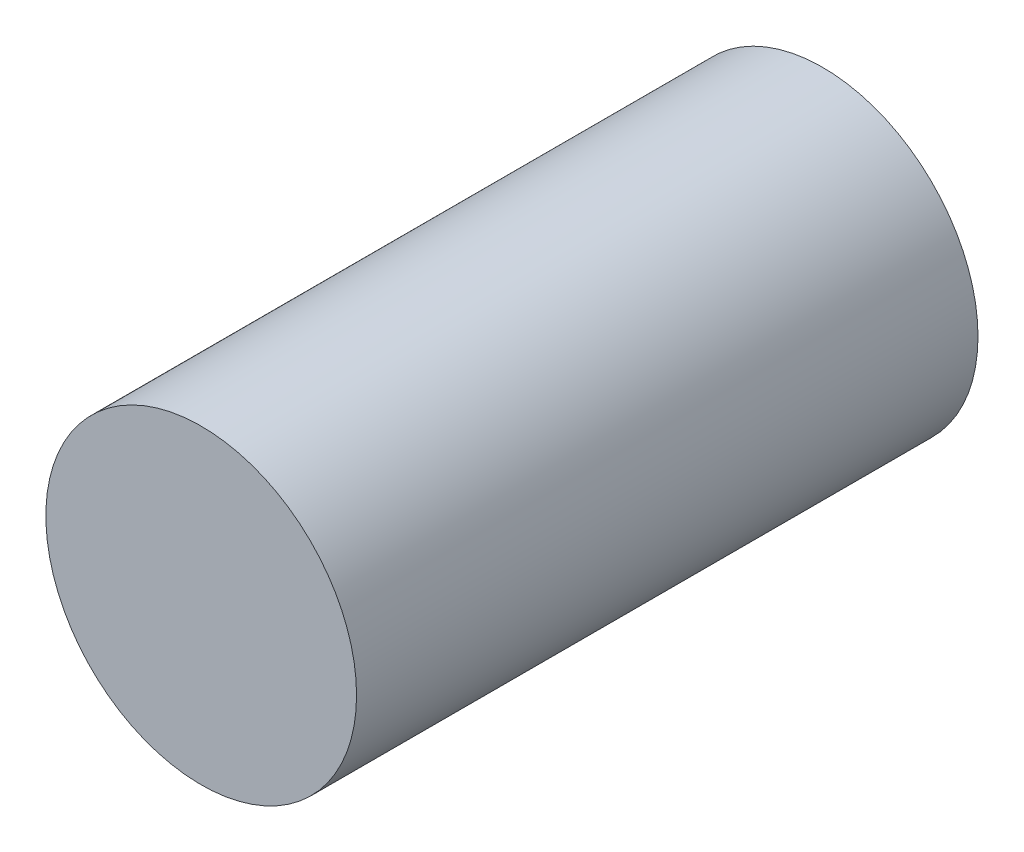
SolidWorks part; units mm, degrees
ref_plane "Ebene vorne" through (0, 0, 0) normal (0, 0, 1) x (1, 0, 0)
ref_plane "Ebene oben" through (0, 0, 0) normal (0, 1, 0) x (1, 0, 0)
ref_plane "Ebene rechts" through (0, 0, 0) normal (1, 0, 0) x (0, 0, -1)
sketch "Skizze1" plane through (0, 0, 0) normal (0, 0, 1) x (1, 0, 0)
  circle A0 centre (0, 0) radius 50
  dimension "D1" = 100
extrude "Linear austragen1" add sketch "Skizze1" along normal blind 200
sketch "Skizze2" plane through (0, 0, 0) normal (0, 1, 0) x (1, 0, 0)
  line L0 (-78.5, -175) -> (-78.5, -142.6421) construction
  line L2 (-77.0355, -139.1066) -> (-1.4645, -63.5355) construction
  line L3 (0, -60) -> (0, -25) construction
  line L5 (-75.5, -175) -> (-75.5, -142.6421)
  line L6 (-74.9142, -141.2279) -> (0.6569, -65.6569)
  line L7 (3, -60) -> (3, -25)
  line L8 (-81.5, -175) -> (-81.5, -142.6421)
  line L9 (-79.1569, -136.9853) -> (-3.5858, -61.4142)
  line L10 (-3, -60) -> (-3, -25)
  line L11 (0, -55) -> (0, 55) construction
  line L12 (-50, -200) -> (50, -200) construction
  line L13 (-55, 0) -> (55, 0) construction
  arc A0 (-78.5, -142.6421) -> (-77.0355, -139.1066) centre (-73.5, -142.6421) cw construction
  arc A1 (-1.4645, -63.5355) -> (0, -60) centre (-5, -60) ccw construction
  arc A2 (-75.5, -142.6421) -> (-74.9142, -141.2279) centre (-73.5, -142.6421) cw
  arc A3 (0.6569, -65.6569) -> (3, -60) centre (-5, -60) ccw
  arc A4 (-81.5, -142.6421) -> (-79.1569, -136.9853) centre (-73.5, -142.6421) cw
  arc A5 (-3.5858, -61.4142) -> (-3, -60) centre (-5, -60) ccw
  arc A6 (-75.5, -175) -> (-81.5, -175) centre (-78.5, -175) cw
  arc A7 (3, -25) -> (-3, -25) centre (0, -25) ccw
  dimension "D1" = 5
  dimension "D9" = 60
  dimension "D4" = 78.5
  dimension "D6" = 45
  dimension "D7" = 25
  dimension "D8" = 25
  dimension "D2" = 3
  dimension "D3" = 3
wrap "Umwickeln1" sketch "Skizze2" wrap type deboss source sketch "Skizze2" thickness 3 parameters "D1"=3
